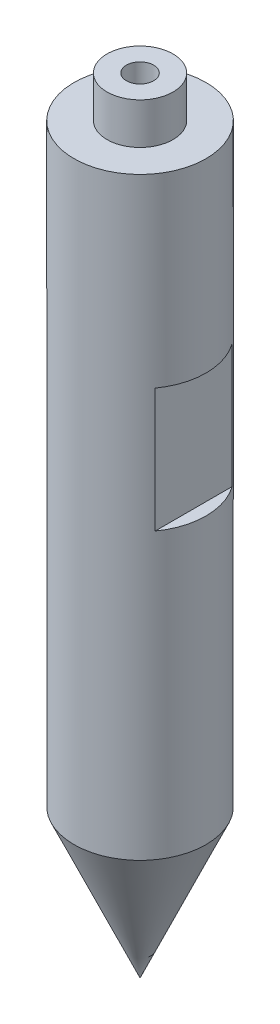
SolidWorks part; units mm, degrees
ref_plane "前视基准面" through (0, 0, 0) normal (0, 0, 1) x (1, 0, 0)
ref_plane "上视基准面" through (0, 0, 0) normal (0, 1, 0) x (1, 0, 0)
ref_plane "右视基准面" through (0, 0, 0) normal (1, 0, 0) x (0, 0, -1)
sketch "草图1" plane through (0, 0, 0) normal (0, 0, 1) x (1, 0, 0)
  line L9 (0, 0) -> (-8, 0)
  line L10 (-8, 0) -> (-8, -72)
  line L14 (0, -90) -> (0, 0)
  line L16 (-8, -72) -> (0, -90)
revolve "旋转1" add sketch "草图1" angle 360 about L14
sketch "草图4" plane through (0, 0, 0) normal (0, 1, 0) x (1, 0, 0)
  line L0 (0, 8) -> (0, -8) construction
  circle A1 centre (0, 0) radius 8 construction
  point P5 (0, 0)
ref_plane "基准面1" through (0, 0, 10.5) normal (0, 0, 1) x (1, 0, 0)
sketch "草图10" plane through (0, 0, 0) normal (0, 1, 0) x (1, 0, 0)
  circle A0 centre (0, 0) radius 4
  dimension "D1" = 8
extrude "凸台-拉伸1" add sketch "草图10" along normal blind 5
sketch "草图19" plane through (0, 0, 0) normal (0, 0, 1) x (1, 0, 0)
  line L0 (0, 5) -> (0, -90) construction
  line L1 (4, 5) -> (-4, 5) construction
  line L3 (-6.5, -37.5) -> (6.5, -37.5) construction
  line L4 (-6.5, -37.5) -> (-6.5, -22.5) construction
  line L5 (-6.5, -22.5) -> (6.5, -22.5) construction
  line L6 (6.5, -37.5) -> (6.5, -22.5) construction
  line L7 (-6.5, -37.5) -> (6.5, -22.5) construction
  line L8 (-6.5, -22.5) -> (6.5, -37.5) construction
  line L9 (6.5, -22.5) -> (46.5, -22.5)
  line L10 (6.5, -22.5) -> (6.5, -37.5)
  line L11 (6.5, -37.5) -> (46.5, -37.5)
  line L12 (46.5, -22.5) -> (46.5, -37.5)
  line L13 (-6.5, -22.5) -> (-46.5, -22.5)
  line L14 (-6.5, -22.5) -> (-6.5, -37.5)
  line L15 (-6.5, -37.5) -> (-46.5, -37.5)
  line L16 (-46.5, -22.5) -> (-46.5, -37.5)
  point P5 (0, -30)
extrude "切除-拉伸1" cut sketch "草图19" against normal through all and the other way through all
hole_wizard "M4 螺纹孔1" positions "草图21" profile "草图22" tap size "M4" standard "ISO"
sketch "草图21" plane through (0, 5, 0) normal (0, 1, 0) x (1, 0, 0)
  point P0 (0, 0)
sketch "草图22" plane through (0, 5, 0) normal (1, 0, 0) x (0, 0, 1)
  line L0 (0, 0) -> (0, 11.0914)
  line L1 (0, 11.0914) -> (1.65, 10.1)
  line L2 (1.65, 10.1) -> (1.65, 0)
  line L5 (1.65, 0) -> (0, 0)
  line L10 (0, 11.0914) -> (-1.65, 10.1) construction
  line L11 (0, -6.35) -> (0, 107.95) construction
  dimension "螺纹孔钻头直径" = 3.3
  dimension "螺纹孔钻头深度" = 10.1
  dimension "导头角度" = 118
equation "\"总长度\"= 90"
equation "\"顶螺纹长度\"=5"
equation "\"台阶长度\"= 10"
equation "\"顶尖长度\"= 15"
equation "\"中段长度\"= \"总长度\" - \"顶螺纹长度\" - \"顶螺纹长度\" - \"台阶长度\""
equation "\"D4@草图1\"=\"总长度\""
equation "\"半径\"= 8"
equation "\"D1@凸台-拉伸1\"=\"顶螺纹长度\""
equation "\"D1@草图19\"=\"中段长度\"/2"
equation "\"D2@草图19\"=\"半径\"*2-3"
equation "\"D1@草图1\"=\"半径\""
